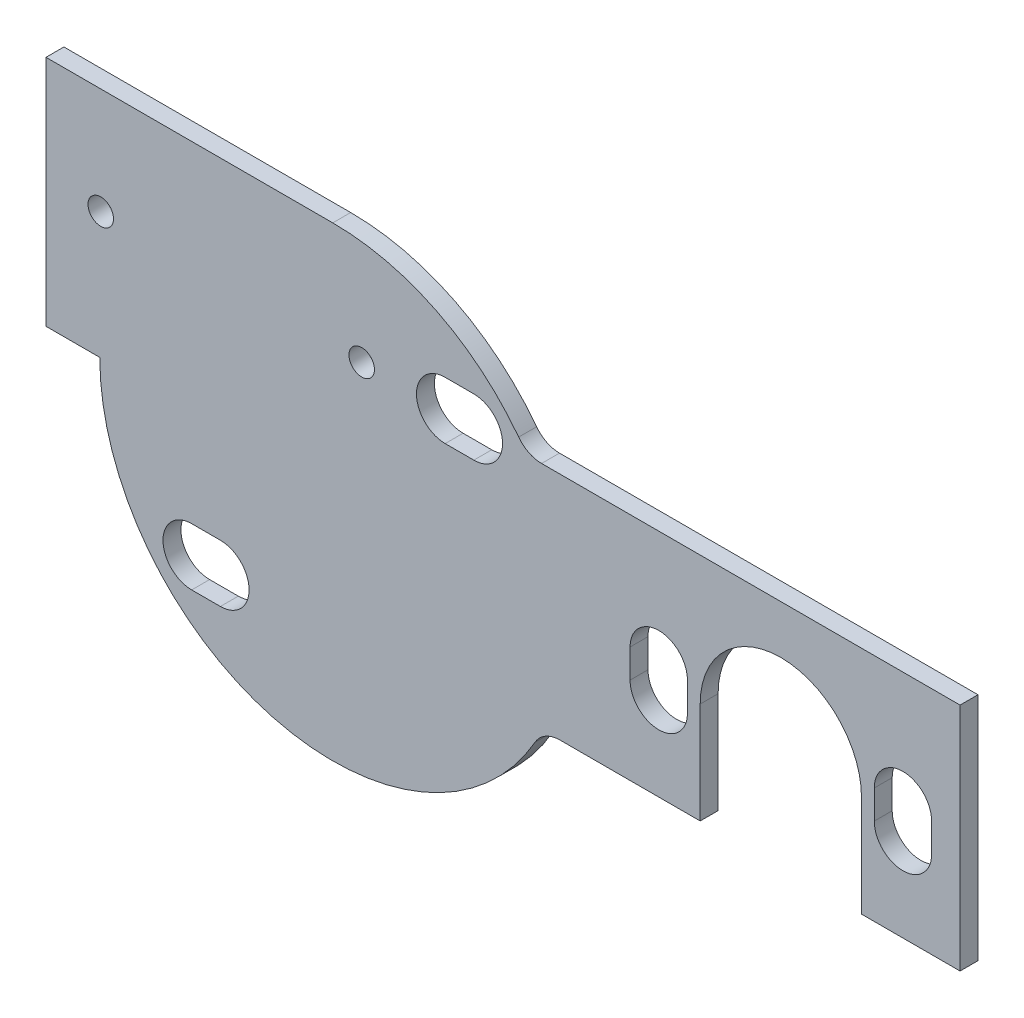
SolidWorks part; units mm, degrees
ref_plane "Front Plane" through (0, 0, 0) normal (0, 0, 1) x (1, 0, 0)
ref_plane "Top Plane" through (0, 0, 0) normal (0, 1, 0) x (1, 0, 0)
ref_plane "Right Plane" through (0, 0, 0) normal (1, 0, 0) x (0, 0, -1)
sketch "Sketch1" plane through (0, 0, 0) normal (0, 0, 1) x (1, 0, 0)
  line L0 (33.4645, 8.9715) -> (45.9105, 8.9715) construction
  line L1 (20.1167, 0) -> (32.5438, 0)
  line L2 (0, 8.9715) -> (0, 36.5515) construction
  line L3 (11.0168, 20.4015) -> (11.43, 20.4015)
  line L4 (55.5625, 0) -> (55.5625, 20.4015)
  line L5 (45.9105, 8.9715) -> (50.7365, 8.9715) construction
  line L6 (50.7365, 8.9715) -> (55.5625, 8.9715) construction
  line L7 (33.4645, 8.9715) -> (28.6385, 8.9715) construction
  line L8 (23.8125, 20.4015) -> (23.8125, 0) construction
  line L9 (28.6385, 8.9715) -> (23.8125, 8.9715) construction
  line L10 (32.5438, 8.9715) -> (32.5438, 0)
  line L11 (46.8312, 8.9715) -> (46.8313, 0)
  line L12 (46.8313, 0) -> (55.5625, 0)
  line L13 (0, 8.9715) -> (21.6199, 30.5914) construction
  line L14 (0, 8.9715) -> (-26.165, -17.1935) construction
  line L15 (18.4942, 20.4015) -> (55.5625, 20.4015)
  line L16 (0, 29.609) -> (-25.4, 29.609)
  line L17 (-25.4, 29.609) -> (-25.4, 8.9715)
  line L18 (-25.4, 8.9715) -> (-20.6375, 8.9715)
  arc A0 (16.4674, 21.4106) -> (0, 29.609) centre (0, 8.9715) ccw
  arc A1 (46.8312, 8.9715) -> (32.5438, 8.9715) centre (39.6875, 8.9715) ccw
  circle A2 centre (0, 8.9715) radius 15.875 construction
  arc A3 (20.1167, 0) -> (17.9121, -1.2785) centre (20.1167, -2.54) ccw
  arc A4 (18.4942, 20.4015) -> (16.4674, 21.4106) centre (18.4942, 22.9415) cw
  circle A5 centre (-1.4986, 20.4015) radius 1.651 construction
  circle A6 centre (-24.6126, 20.4015) radius 1.651 construction
  arc A7 (-20.6375, 8.9715) -> (17.9121, -1.2785) centre (0, 8.9715) ccw
  point P7 (50.7365, 8.9715)
  point P8 (28.6385, 8.9715)
  point P9 (39.6875, 8.9715)
  dimension "D1" = 41.275
  dimension "D6" = 14.2875
  dimension "D7" = 31.75
  dimension "D9" = 2.54
  dimension "D11" = 3.302
  dimension "D2" = 55.5625
  dimension "D3" = 12.446
  dimension "D4" = 31.75
  dimension "D5" = 11.43
  dimension "D8" = 45
  dimension "D10" = 23.114
  dimension "D12" = 25.4
extrude "Extrude1" add sketch "Sketch1" along normal blind 1.5875
sketch "Sketch2" plane through (0, 0, 1.5875) normal (0, 0, 1) x (1, 0, 0)
  line L0 (26.3335, 10.2415) -> (26.3335, 7.7015)
  line L1 (31.4135, 7.7015) -> (31.4135, 10.2415)
  line L2 (47.9615, 7.7015) -> (47.9615, 10.2415)
  line L3 (53.0416, 7.7015) -> (53.0416, 10.2415)
  line L4 (31.4135, 8.9715) -> (32.5438, 8.9715) construction
  line L5 (46.8312, 8.9715) -> (47.9615, 8.9715) construction
  line L6 (11.2253, 20.1968) -> (-11.2253, -2.2538) construction
  line L7 (0, 8.9715) -> (0, 24.8465) construction
  line L8 (12.4953, 20.1968) -> (9.9553, 20.1968) construction
  line L9 (-9.9553, -2.2538) -> (-12.4953, -2.2538) construction
  line L10 (12.4953, 17.6568) -> (9.9553, 17.6568)
  line L11 (12.4953, 22.7368) -> (9.9553, 22.7368)
  line L12 (-9.9553, -4.7938) -> (-12.4953, -4.7938)
  line L13 (-9.9553, 0.2862) -> (-12.4953, 0.2862)
  arc A0 (26.3335, 7.7015) -> (31.4135, 7.7015) centre (28.8735, 7.7015) ccw
  arc A1 (31.4135, 10.2415) -> (26.3335, 10.2415) centre (28.8735, 10.2415) ccw
  arc A2 (53.0416, 10.2415) -> (47.9615, 10.2415) centre (50.5016, 10.2415) ccw
  arc A3 (47.9615, 7.7015) -> (53.0416, 7.7015) centre (50.5016, 7.7015) ccw
  circle A4 centre (0, 8.9715) radius 15.875 construction
  arc A5 (16.4674, 21.4106) -> (0, 29.609) centre (0, 8.9715) ccw construction
  arc A6 (9.9553, 22.7368) -> (9.9553, 17.6568) centre (9.9553, 20.1968) ccw
  arc A8 (12.4953, 17.6568) -> (12.4953, 22.7368) centre (12.4953, 20.1968) ccw
  arc A9 (-12.4953, 0.2862) -> (-12.4953, -4.7938) centre (-12.4953, -2.2538) ccw
  arc A10 (-9.9553, -4.7938) -> (-9.9553, 0.2862) centre (-9.9553, -2.2538) ccw
  dimension "D2" = 5.08
  dimension "D4" = 31.75
  dimension "D6" = 5.08
  dimension "D1" = 21.6281
  dimension "D3" = 2.54
  dimension "D5" = 45
  dimension "D7" = 2.54
extrude "Cut-Extrude1" cut sketch "Sketch2" against normal through all
hole_wizard "#4-40 Tapped Hole1" positions "3DSketch1" profile "Sketch4" tap size "#4-40" standard "Ansi Inch"
sketch3d "3DSketch1"
  line L4 (7.4153, 20.1978, 1.5875) -> (2.5647, 20.1978, 1.5875) construction
  line L7 (-20.5493, 20.1978, 1.5875) -> (-25.4, 20.1978, 1.5875) construction
  line L8 (-25.4, 8.9715, 1.5875) -> (-25.4, 29.609, 1.5875) construction
  arc A1 (9.9553, 22.7368, 1.5875) -> (9.9553, 17.6568, 1.5875) centre (9.9553, 20.1968, 1.5875) ccw construction
  point P0 (-20.5493, 20.1978, 1.5875)
  point P2 (2.5647, 20.1978, 1.5875)
  point P24 (9.9553, 20.1968, 4.1275)
  dimension "D1" = 23.114
sketch "Sketch4" plane through (-20.5493, 20.1978, 1.5875) normal (1, 0, 0) x (0, -1, 0)
  line L0 (0, 0) -> (0, 1.5875)
  line L1 (0, 1.5875) -> (1.1303, 1.5875)
  line L2 (1.1303, 1.5875) -> (1.1303, 0)
  line L5 (1.1303, 0) -> (0, 0)
  line L11 (0, -6.35) -> (0, 107.95) construction
  dimension "Thru Tap Drill Dia." = 2.2606
  dimension "Thru Tap Drill Depth" = 1.5875
